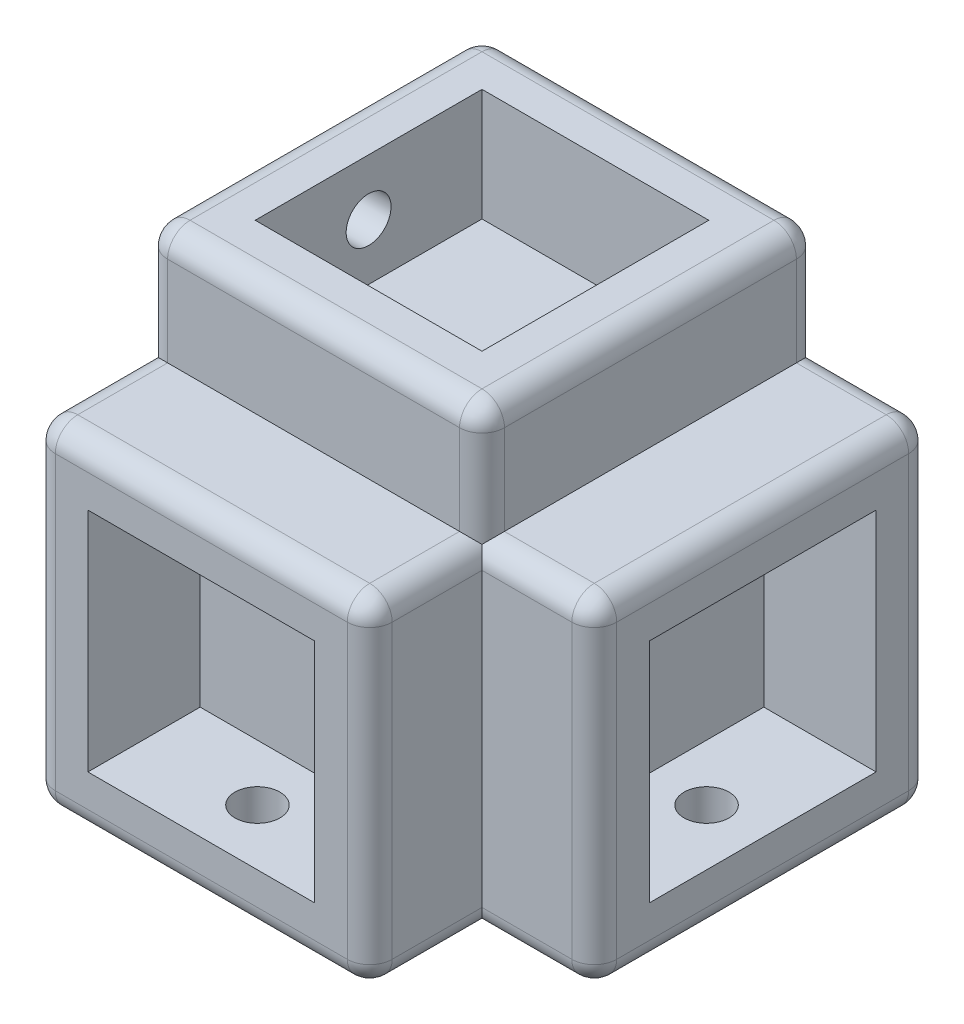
SolidWorks part; units mm, degrees
ref_plane "Alzado" through (0, 0, 0) normal (0, 0, 1) x (1, 0, 0)
ref_plane "Planta" through (0, 0, 0) normal (0, 1, 0) x (1, 0, 0)
ref_plane "Vista lateral" through (0, 0, 0) normal (1, 0, 0) x (0, 0, -1)
sketch "Sketch1" plane through (0, 0, 0) normal (0, 0, 1) x (1, 0, 0)
  line L1 (0, 40) -> (30, 40)
  line L2 (0, 40) -> (0, 0)
  line L3 (0, 0) -> (40, 0)
  line L4 (30, 40) -> (30, 30)
  line L5 (40, 0) -> (0, 0)
  line L6 (40, 0) -> (40, 30)
  line L7 (40, 30) -> (30, 30)
  line L8 (0, 0) -> (0, 40)
  dimension "D1" = 30
  dimension "D2" = 30
  dimension "D3" = 10
  dimension "D4" = 10
extrude "Boss-Extrude1" add sketch "Sketch1" along normal blind 30 contours L2 L1 L4 L7 L6 L5
sketch "Sketch2" plane through (0, 0, 30) normal (0, 0, 1) x (1, 0, 0)
  line L1 (30, 30) -> (0, 30)
  line L2 (30, 30) -> (30, 0)
  line L3 (30, 0) -> (0, 0)
  line L4 (0, 30) -> (0, 0)
extrude "Boss-Extrude2" add sketch "Sketch2" along normal blind 10
sketch "Sketch3" plane through (0, 0, 40) normal (0, 0, 1) x (1, 0, 0)
  line L0 (0, 0) -> (30, 0) construction
  line L1 (4.9, 25.1) -> (25.1, 25.1)
  line L2 (4.9, 25.1) -> (4.9, 4.9)
  line L3 (4.9, 4.9) -> (25.1, 4.9)
  line L4 (25.1, 25.1) -> (25.1, 4.9)
  line L5 (4.9, 25.1) -> (25.1, 4.9) construction
  line L6 (4.9, 4.9) -> (25.1, 25.1) construction
  line L7 (0, 30) -> (0, 0) construction
  point P0 (15, 15)
  point P8 (15, 0)
  point P11 (0, 15)
  dimension "D1" = 20.2
  dimension "D2" = 20.2
extrude "Cut-Extrude1" cut sketch "Sketch3" against normal blind 10
sketch "Sketch4" plane through (40, 0, 0) normal (1, 0, 0) x (0, 0, -1)
  line L0 (0, 0) -> (0, 30) construction
  line L1 (-25.1, 25.1) -> (-4.9, 25.1)
  line L2 (-25.1, 25.1) -> (-25.1, 4.9)
  line L3 (-25.1, 4.9) -> (-4.9, 4.9)
  line L4 (-4.9, 25.1) -> (-4.9, 4.9)
  line L5 (-25.1, 25.1) -> (-4.9, 4.9) construction
  line L6 (-25.1, 4.9) -> (-4.9, 25.1) construction
  line L7 (-30, 0) -> (0, 0) construction
  point P0 (-15, 15)
  point P7 (0, 15)
  point P10 (-15, 0)
  dimension "D1" = 20.2
  dimension "D2" = 20.2
extrude "Cut-Extrude2" cut sketch "Sketch4" against normal blind 10
sketch "Sketch5" plane through (0, 40, 0) normal (0, 1, 0) x (1, 0, 0)
  line L0 (0, -30) -> (0, 0) construction
  line L1 (4.9, -4.9) -> (25.1, -4.9)
  line L2 (4.9, -4.9) -> (4.9, -25.1)
  line L3 (4.9, -25.1) -> (25.1, -25.1)
  line L4 (25.1, -4.9) -> (25.1, -25.1)
  line L5 (4.9, -4.9) -> (25.1, -25.1) construction
  line L6 (4.9, -25.1) -> (25.1, -4.9) construction
  line L7 (0, -30) -> (30, -30) construction
  point P0 (15, -15)
  point P7 (0, -15)
  point P10 (15, -30)
  dimension "D1" = 20.2
  dimension "D2" = 20.2
extrude "Cut-Extrude3" cut sketch "Sketch5" against normal blind 10
fillet "Fillet2" radius 2 1 edges at (30, 30, 35)
fillet "Fillet3" radius 2 1 edges at (35, 30, 30)
fillet "Fillet4" radius 2 1 edges at (30, 34, 30)
fillet "Fillet5" radius 2 2 edges at (35, 30, 0) (30, 35, 0)
fillet "Fillet6" radius 2 2 edges at (35, 0, 30) (30, 0, 35)
fillet "Fillet7" radius 2 5 edges at (14, 0, 40) (29.4142, 0.5858, 40) (14, 30, 40) (29.4142, 29.4142, 40) (30, 15, 40)
fillet "Fillet8" radius 2 5 edges at (0, 30, 34) (0, 29.4142, 39.4142) (0, 0, 19) (0, 0.5858, 39.4142) (0, 15, 40)
fillet "Fillet9" radius 2 10 edges at (21, 0, 0) (0.5858, 0.5858, 0) (14, 40, 30) (29.4142, 40, 29.4142) (14, 40, 0) (29.4142, 40, 0.5858) (0, 21, 0) (0, 40, 15) (30, 40, 15) (0, 34, 30)
fillet "Fillet10" radius 2 8 edges at (40, 0.5858, 0.5858) (40, 0, 15) (40, 0.5858, 29.4142) (40, 15, 30) (40, 29.4142, 29.4142) (40, 30, 15) (40, 29.4142, 0.5858) (40, 15, 0)
sketch "Sketch6" plane through (0, 0, 0) normal (0, 0, -1) x (-1, 0, 0)
  line L0 (-2, 0) -> (-38, 0) construction
  line L2 (0, 38) -> (0, 2) construction
  circle A1 centre (-8, 15.13) radius 2.5
  circle A2 centre (-23, 15.13) radius 2.5
  dimension "D3" = 5
  dimension "D4" = 5
  dimension "D1" = 8
  dimension "D2" = 15.13
  dimension "D5" = 15
extrude "Cut-Extrude4" cut sketch "Sketch6" against normal blind 10
sketch "Sketch7" plane through (0, 30, 0) normal (0, 1, 0) x (1, 0, 0)
  line L0 (28, -40) -> (2, -40) construction
  line L1 (40, -2) -> (40, -28) construction
  line L2 (2, -38) -> (28, -38) construction
  line L3 (38, -28) -> (38, -2) construction
  circle A0 centre (35, -15) radius 2
  circle A1 centre (15, -35) radius 2
  point P10 (15, -38)
  point P13 (38, -15)
extrude "Cut-Extrude5" cut sketch "Sketch7" against normal blind 50
sketch "Sketch8" plane through (0, 0, 0) normal (-1, 0, 0) x (0, 0, 1)
  line L0 (2, 40) -> (28, 40) construction
  line L1 (28, 38) -> (2, 38) construction
  circle A0 centre (15, 35) radius 2
  point P6 (15, 38)
extrude "Cut-Extrude6" cut sketch "Sketch8" against normal blind 50
sketch "Sketch9" plane through (0, 30, 0) normal (0, 1, 0) x (1, 0, 0)
  circle A0 centre (35.0204, -15.1917) radius 2.7751
extrude "Boss-Extrude3" add sketch "Sketch9" against normal up to surface (4.9 mm away)
sketch "Sketch10" plane through (30, 0, 0) normal (1, 0, 0) x (0, 0, -1)
  circle A0 centre (-14.9692, 34.4271) radius 2.8314
extrude "Boss-Extrude4" add sketch "Sketch10" against normal up to surface (4.9 mm away)
sketch "Sketch11" plane through (0, 30, 0) normal (0, 1, 0) x (1, 0, 0)
  circle A0 centre (15.024, -34.6256) radius 3.0679
extrude "Boss-Extrude5" add sketch "Sketch11" against normal up to surface (4.9 mm away)
equation "\"tornillo\"=4"
equation "\"D1@Sketch7\"=\"tornillo\""
equation "\"D2@Sketch7\"=\"tornillo\""
equation "\"D2@Sketch8\"=\"tornillo\""
equation "\"tolerancia\"=20.2"
